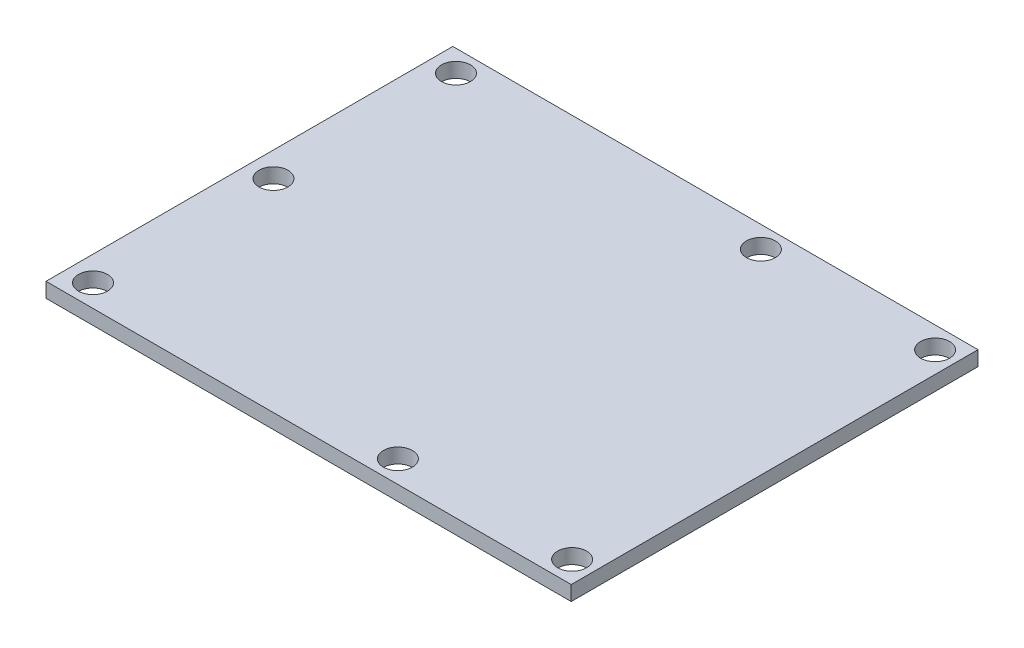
SolidWorks part; units mm, degrees
ref_plane "前视基准面" through (0, 0, 0) normal (0, 0, 1) x (1, 0, 0)
ref_plane "上视基准面" through (0, 0, 0) normal (0, 1, 0) x (1, 0, 0)
ref_plane "右视基准面" through (0, 0, 0) normal (1, 0, 0) x (0, 0, -1)
sketch "草图2" plane through (0, 0, 0) normal (0, 1, 0) x (1, 0, 0)
  line L0 (-48.8419, 38.0269) -> (22.3277, 38.0269)
  line L1 (22.3277, 38.0269) -> (22.3277, -17.0947)
  line L2 (22.3277, -17.0947) -> (-48.8419, -17.0947)
  line L3 (-48.8419, -17.0947) -> (-48.8419, 38.0269)
extrude "凸台-拉伸1" add sketch "草图2" against normal blind 2
sketch "草图8" plane through (0, 0, 0) normal (0, 1, 0) x (1, 0, 0)
  circle A0 centre (-45.4837, 35.1006) radius 1.9643
sketch "草图9" plane through (0, 0, 0) normal (0, 1, 0) x (1, 0, 0)
  circle A0 centre (-45.4837, 10.3671) radius 1.9643
  circle A1 centre (-45.4837, -14.0854) radius 1.9643
  circle A2 centre (-4.1674, -14.0854) radius 1.9643
  circle A3 centre (19.4419, -14.0854) radius 1.9643
  circle A4 centre (19.4419, 35.1006) radius 1.9643
  circle A5 centre (-45.4837, 35.1006) radius 1.9643
  circle A6 centre (-4.1674, 35.1006) radius 1.9643
extrude "切除-拉伸2" cut sketch "草图9" against normal blind 10
